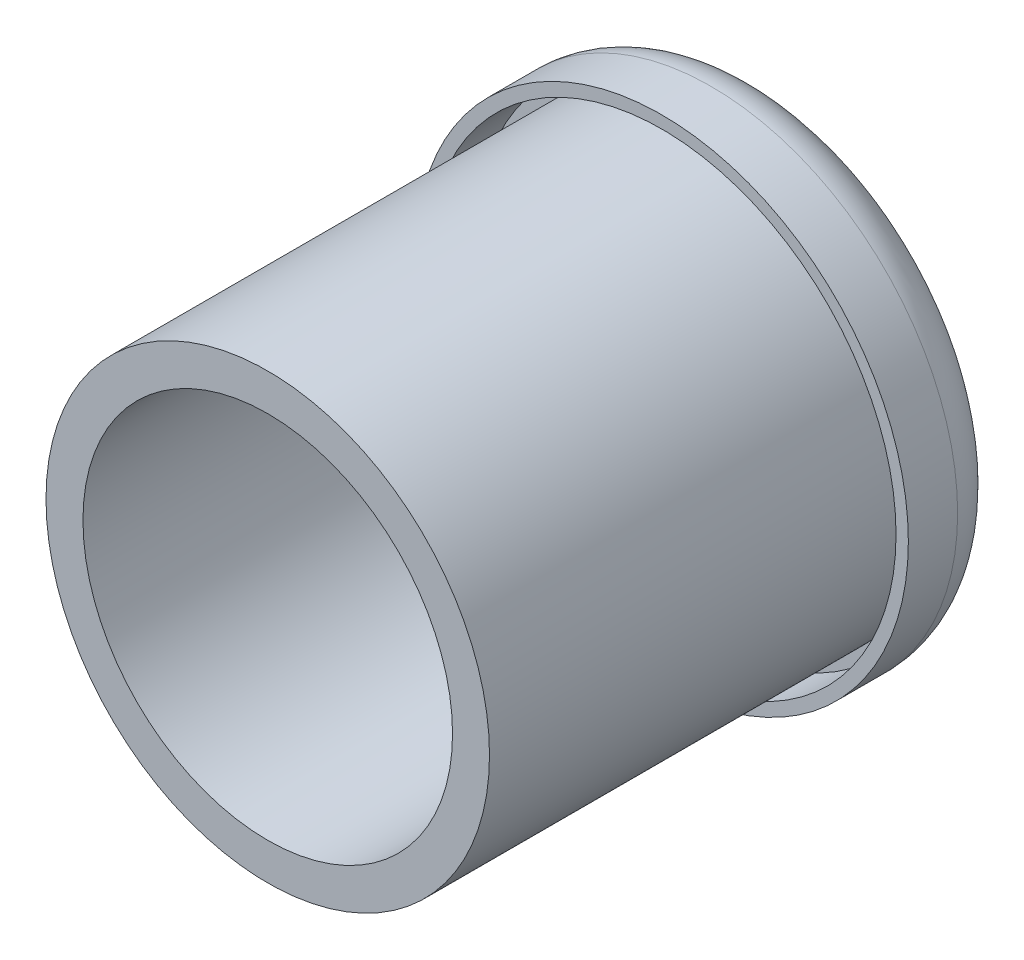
SolidWorks part; units mm, degrees
ref_plane "Plan de face" through (0, 0, 0) normal (0, 0, 1) x (1, 0, 0)
ref_plane "Plan de dessus" through (0, 0, 0) normal (0, 1, 0) x (1, 0, 0)
ref_plane "Plan de droite" through (0, 0, 0) normal (1, 0, 0) x (0, 0, -1)
sketch "Esquisse1" plane through (0, 0, 0) normal (0, 0, 1) x (1, 0, 0)
  circle A0 centre (0, 0) radius 5
  dimension "D1" = 10
extrude "Extrusion1" add sketch "Esquisse1" along normal blind 10
sketch "Esquisse2" plane through (0, 0, 10) normal (0, 0, 1) x (1, 0, 0)
  circle A0 centre (0, 0) radius 3.75
  dimension "D1" = 7.5
extrude "Enlèv. mat.-Extru.1" cut sketch "Esquisse2" against normal through all
sketch "Esquisse3" plane through (0, 0, 10) normal (0, 0, 1) x (1, 0, 0)
  circle A0 centre (0, 0) radius 4.5
  circle A1 centre (0, 0) radius 4.75
  dimension "D1" = 9
  dimension "D2" = 9.5
extrude "Enlèv. mat.-Extru.2" cut sketch "Esquisse3" against normal blind 9
sketch "Esquisse4" plane through (0, 0, 10) normal (0, 0, 1) x (1, 0, 0)
  circle A0 centre (0, 0) radius 4.75
  circle A1 centre (0, 0) radius 5
  dimension "D1" = 9.5
  dimension "D2" = 10
extrude "Enlèv. mat.-Extru.3" cut sketch "Esquisse4" against normal blind 8
fillet "Congé1" radius 1 1 edges at (5, 0, 0)
